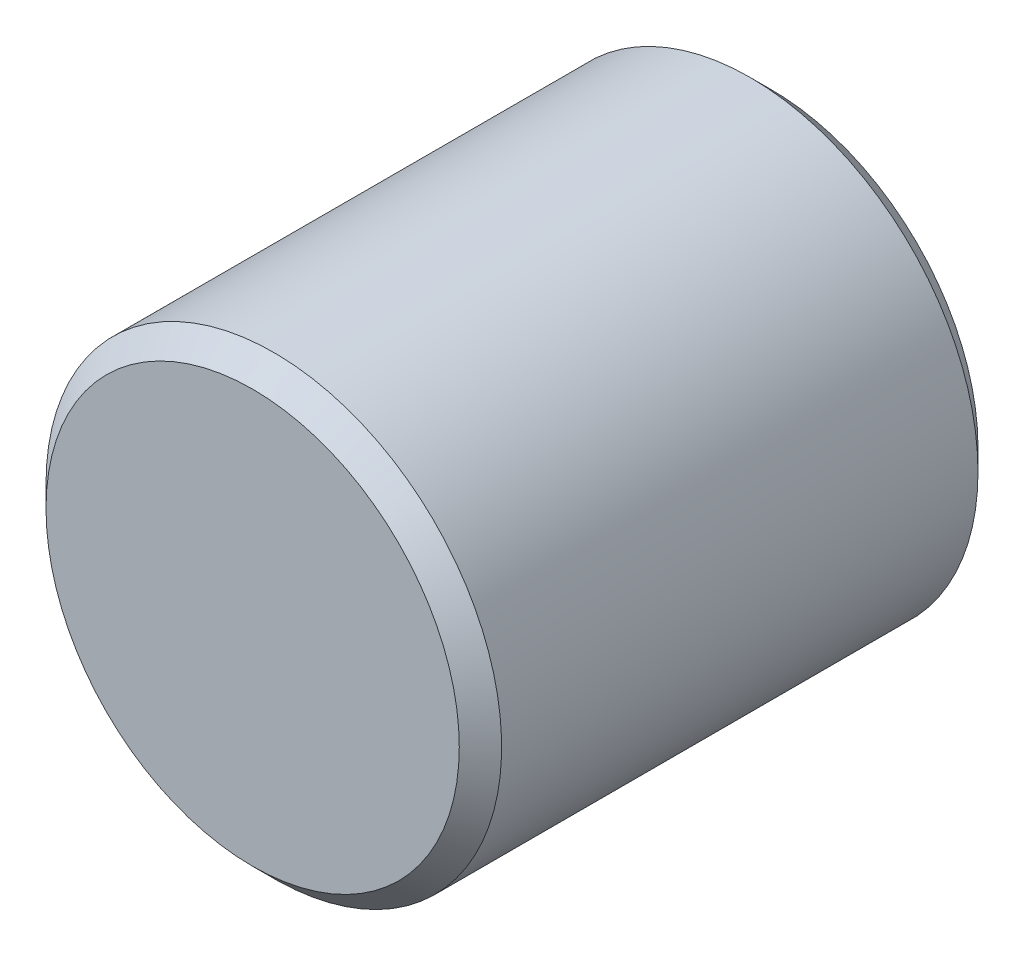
SolidWorks part; units mm, degrees
ref_plane "front" through (0, 0, 0) normal (0, 0, 1) x (1, 0, 0)
ref_plane "top" through (0, 0, 0) normal (0, 1, 0) x (1, 0, 0)
ref_plane "side" through (0, 0, 0) normal (1, 0, 0) x (0, 0, -1)
sketch "Sketch1" plane through (0, 0, 0) normal (0, 0, 1) x (1, 0, 0)
  circle A0 centre (0, 0) radius 6.8326
  dimension "D1" = 13.6652
extrude "Boss-Extrude1" add sketch "Sketch1" along normal blind 15.5575
chamfer "Chamfer1" distance 0.635 angle 45 2 edges at (6.8326, 0, 0) (6.8326, 0, 15.5575)
